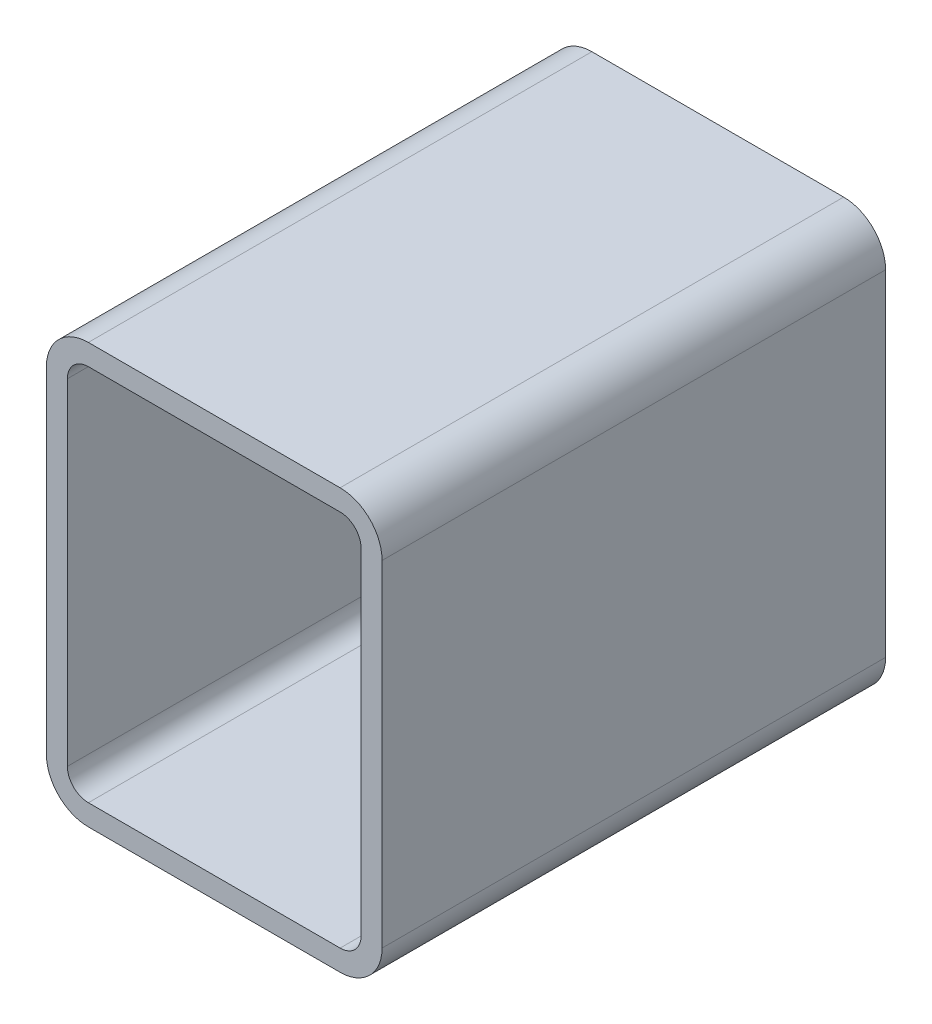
SolidWorks part; units mm, degrees
ref_plane "Front Plane" through (0, 0, 0) normal (0, 0, 1) x (1, 0, 0)
ref_plane "Top Plane" through (0, 0, 0) normal (0, 1, 0) x (1, 0, 0)
ref_plane "Right Plane" through (0, 0, 0) normal (1, 0, 0) x (0, 0, -1)
sketch "Sketch1" plane through (0, 0, 0) normal (0, 0, 1) x (1, 0, 0)
sketch_block_instance "HSS10x8x0.500-1"
sketch_block "HSS10x8x0.500"
extrude "Boss-Extrude1" add sketch "Sketch1" along normal blind 304.8
